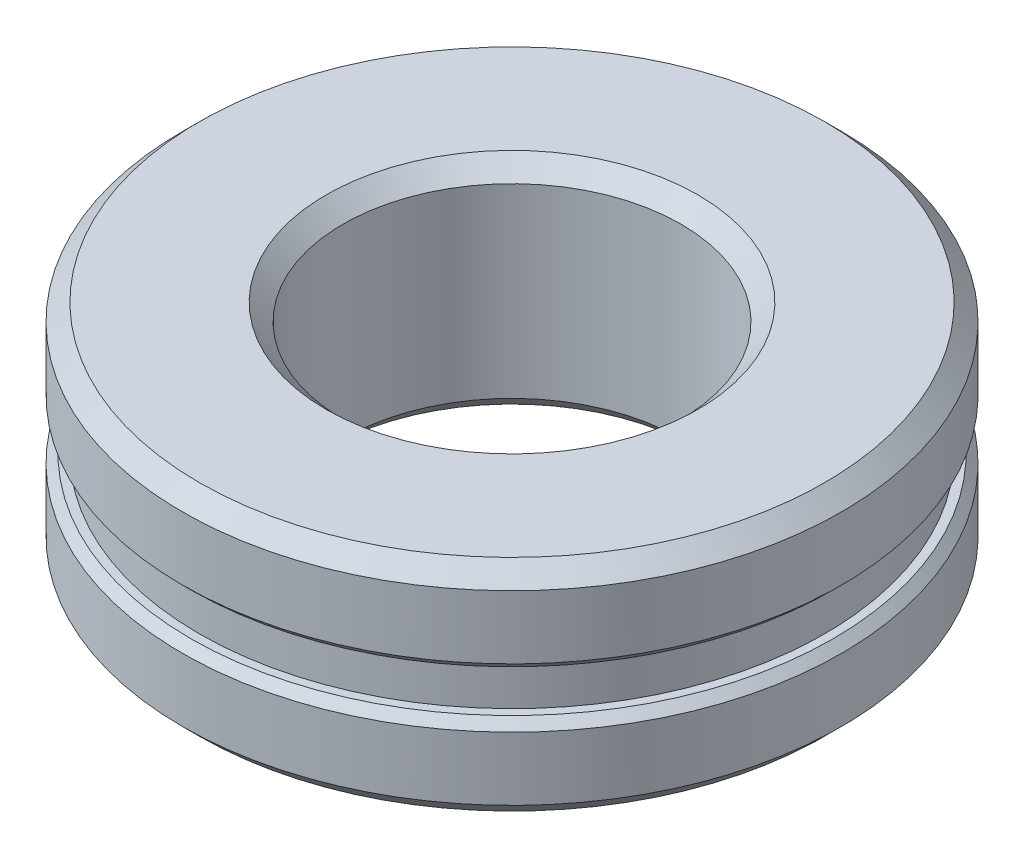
SolidWorks part; units mm, degrees
ref_plane "Alzado" through (0, 0, 0) normal (0, 0, 1) x (1, 0, 0)
ref_plane "Planta" through (0, 0, 0) normal (0, 1, 0) x (1, 0, 0)
ref_plane "Vista lateral" through (0, 0, 0) normal (1, 0, 0) x (0, 0, -1)
sketch "Croquis1" plane through (0, 0, 0) normal (0, 1, 0) x (1, 0, 0)
  circle A0 centre (0, 0) radius 20
  circle A1 centre (0, 0) radius 39
  dimension "D1" = 40
  dimension "D2" = 78
extrude "Saliente-Extruir1" add sketch "Croquis1" along normal mid plane 26
chamfer "Chaflán1" distance 2 angle 45 4 edges at (0, -13, 20) (0, 13, 20) (0, -13, 39) (0, 13, 39)
sketch "Croquis2" plane through (0, 0, 0) normal (0, 1, 0) x (1, 0, 0)
  circle A0 centre (0, 0) radius 39 construction
  circle A1 centre (0, 0) radius 39
  circle A2 centre (0, 0) radius 37 construction
  circle A3 centre (0, 0) radius 37
extrude "Cortar-Extruir1" cut sketch "Croquis2" against normal mid plane 5
chamfer "Chaflán2" distance 1 angle 45 2 edges at (0, 2.5, 39) (0, -2.5, 39)
